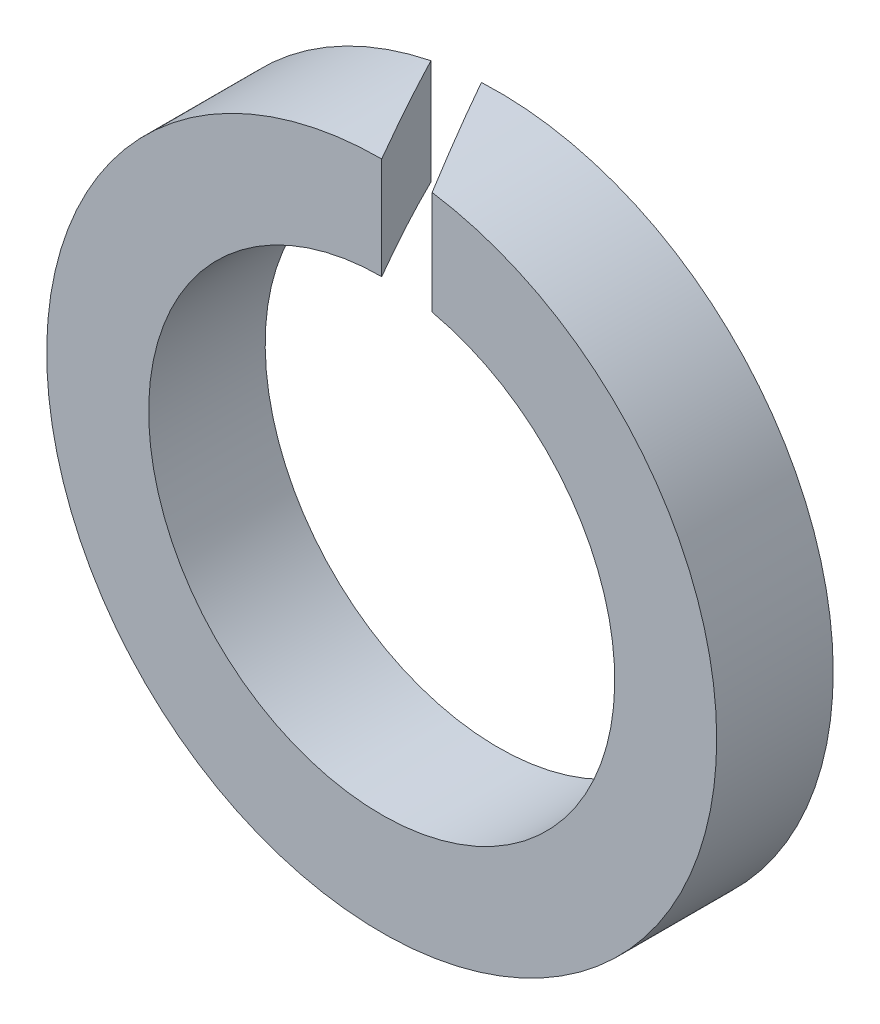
SolidWorks part; units mm, degrees
ref_plane "face" through (0, 0, 0) normal (0, 0, 1) x (1, 0, 0)
ref_plane "dessus" through (0, 0, 0) normal (0, 1, 0) x (1, 0, 0)
ref_plane "profil" through (0, 0, 0) normal (1, 0, 0) x (0, 0, -1)
sketch "Esquisse1" plane through (0, 0, 0) normal (0, 0, 1) x (1, 0, 0)
  circle A0 centre (0, 0) radius 11.5
  dimension "D1" = 23
extrude "Base-Extrusion" add sketch "Esquisse1" against normal blind 4
sketch "Esquisse2" plane through (0, 0, 0) normal (0, 0, 1) x (1, 0, 0)
  circle A0 centre (0, 0) radius 8
  dimension "D1" = 16
extrude "Enlèv. mat.-Extru.1" cut sketch "Esquisse2" against normal blind 6
ref_plane "Plan1" through (0, 11.5, 0) normal (0, 1, 0) x (-1, 0, 0)
sketch "Esquisse3" plane through (0, 11.5, 0) normal (0, 1, 0) x (-1, 0, 0)
  line L0 (0, 0) -> (3.3198, -5.75)
  line L1 (8, 0) -> (-8, 0) construction
  line L3 (1.5877, -5.75) -> (3.3198, -5.75)
  line L8 (-1.7321, 0) -> (1.5877, -5.75)
  line L9 (0, 0) -> (-1.7321, 0)
  dimension "D1" = 60
  dimension "D2" = 1.5
extrude "Enlèv. mat.-Extru.2" cut sketch "Esquisse3" against normal blind 10
